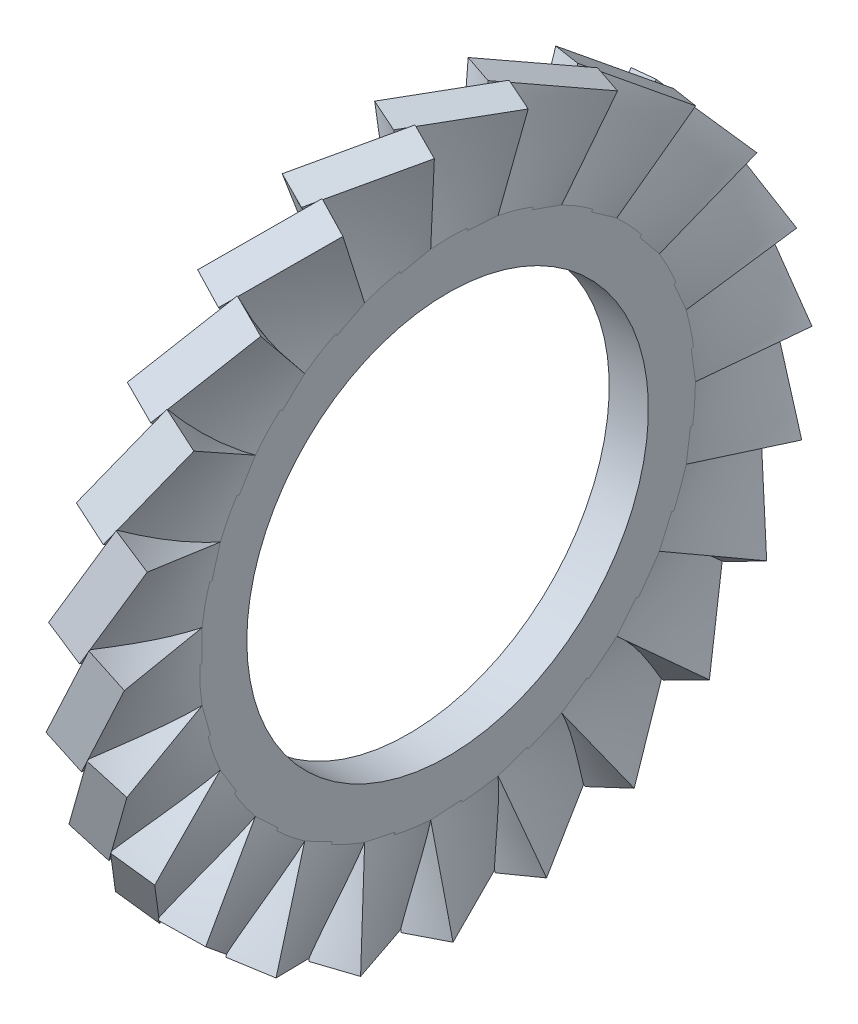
SolidWorks part; units mm, degrees
revolve "Ame rondelle" add sketch "Esquisse1" angle 360 about L0
sketch "Esquisse1" plane through (0, 0, 0) normal (0, 0, 1) x (1, 0, 0)
  line L0 (-4, 0) -> (4, 0) construction
  line L1 (0.4, 4.1) -> (-0.4, 4.1)
  line L2 (-0.4, 4.1) -> (-0.4, 5.06)
  line L3 (-0.4, 5.06) -> (0.4, 5.06)
  line L4 (0, 0) -> (0, 8) construction
  line L5 (0.4, 4.1) -> (0.4, 5.06)
  point P10 (0, 5.06)
  point P11 (0, 4.1)
  dimension "D1" = 4.1
  dimension "D2" = 5.06
  dimension "D3" = 0.4
ref_plane "Plan1" through (0, 0, 0) normal (0, 0, 1) x (1, 0, 0)
ref_plane "Plan2" through (0, 0, 0) normal (0, 1, 0) x (1, 0, 0)
ref_plane "Plan3" through (0, 0, 0) normal (1, 0, 0) x (0, 0, -1)
ref_plane "Plan4" through (0, 0, 5.0129) normal (0, 0, 1) x (1, 0, 0)
ref_plane "Plan5" through (0, 0, 7) normal (0, 0, 1) x (1, 0, 0)
sketch "Esquisse2" plane through (0, 0, 5.0129) normal (0, 0, 1) x (1, 0, 0)
  line L0 (0.4, 0.689) -> (0.4, -0.689)
  line L1 (-0.4, 0.689) -> (0.4, 0.689)
  line L3 (-0.4, 5.06) -> (-0.4, -5.06) construction
  line L4 (-0.4, 0.689) -> (-0.4, -0.689)
  line L5 (-1, 0) -> (1, 0) construction
  line L6 (-4, 0) -> (4, 0) construction
  line L7 (0, 0) -> (0, 1) construction
  line L11 (-0.4, -0.689) -> (0.4, -0.689)
  point P6 (0, -0.689)
  point P14 (0, 0.689)
  point P18 (0.4, 0)
  point P21 (-0.4, 0)
  dimension "D1" = 0.689
sketch "Esquisse4" plane through (0, 0, 7) normal (0, 0, 1) x (1, 0, 0)
  line L0 (0, 0) -> (0.4, 0.8578) construction
  line L1 (0.4, -5.06) -> (0.4, 5.06) construction
  line L2 (0, 0) -> (0.6568, -0.3063) construction
  line L3 (0, 0) -> (0, 1) construction
  line L4 (0.075, 1.1072) -> (0.8, 0.7691)
  line L5 (0.8, 0.7691) -> (-0.075, -1.1072)
  line L7 (0.075, 1.1072) -> (-0.8, -0.7691)
  line L8 (-0.8, -0.7691) -> (-0.075, -1.1072)
  point P12 (0.4375, 0.9382)
  point P14 (-0.3625, 0.169)
  point P15 (0.3625, -0.169)
loft "1 dent" add profiles "Esquisse2", "Esquisse4"
pattern_circular "Répétition dents" count 23 over 360 about axis through (-4, 0, 0) along (1, 0, 0) of "1 dent"
ref_plane "Plan d'appui 1" through (0.8, 0, 0) normal (1, 0, 0) x (0, 0, -1)
ref_plane "Plan d'appui 2" through (-0.8, 0, 0) normal (1, 0, 0) x (0, 0, -1)
equation "\"D2@Esquisse4\" = \"D3@Esquisse1\""
equation "\"D1@Plan d'appui 1\" = \"D3@Esquisse1\"*2"
equation "\"D1@Plan d'appui 2\" = \"D3@Esquisse1\"*2"
